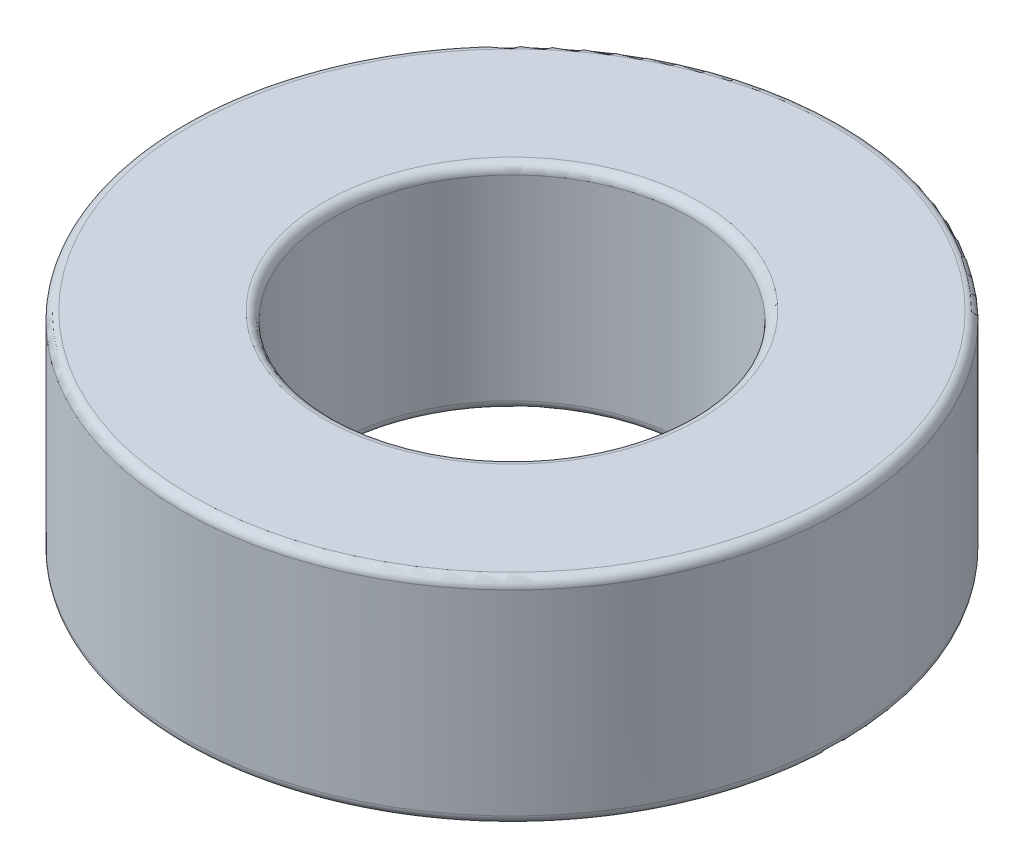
SolidWorks part; units mm, degrees
ref_plane "Front Plane" through (0, 0, 0) normal (0, 0, 1) x (1, 0, 0)
ref_plane "Top Plane" through (0, 0, 0) normal (0, 1, 0) x (1, 0, 0)
ref_plane "Right Plane" through (0, 0, 0) normal (1, 0, 0) x (0, 0, -1)
sketch "Sketch1" plane through (0, 0, 0) normal (1, 0, 0) x (0, 0, -1)
  line L0 (0, 0) -> (0, 9.8315) construction
  line L1 (5.025, 0) -> (5.025, 6)
  line L2 (5.025, 6) -> (9.25, 6)
  line L3 (9.25, 6) -> (9.25, 0)
  line L4 (9.25, 0) -> (8.3439, 0)
  line L5 (8.3439, 0) -> (8.3439, 1.016)
  line L6 (8.0899, 1.27) -> (6.4643, 1.27)
  line L7 (6.2103, 1.016) -> (6.2103, 0)
  line L8 (6.2103, 0) -> (5.025, 0)
  line L11 (9.45, -0.6105) -> (9.45, 0.254) construction
  line L12 (9.45, 0.254) -> (10.4605, 0.254) construction
  arc A0 (8.3439, 1.016) -> (8.0899, 1.27) centre (8.0899, 1.016) ccw
  arc A1 (6.4643, 1.27) -> (6.2103, 1.016) centre (6.4643, 1.016) ccw
  point P7 (9.525, 0.6753)
  point P13 (8.3439, 1.27)
  point P16 (6.2103, 1.27)
  point P22 (9.525, 4.4445)
  point P23 (9.3376, 0)
  point P24 (9.3376, -0.2435)
  dimension "D7" = 0.254
  dimension "D1" = 18.5
  dimension "D2" = 10.05
  dimension "D3" = 6
  dimension "D4" = 12.4206
  dimension "D5" = 2.1336
  dimension "D6" = 1.27
  dimension "D8" = 18.9
  dimension "D9" = 0.254
  dimension "D11" = 1.1853
  dimension "D12" = 0.9061
revolve "Revolve1" add sketch "Sketch1" angle 360 about L0
fillet "Fillet1" radius 0.254 4 edges at (0, 0, -9.25) (0, 6, -9.25) (0, 6, -5.025) (0, 0, -5.025)
